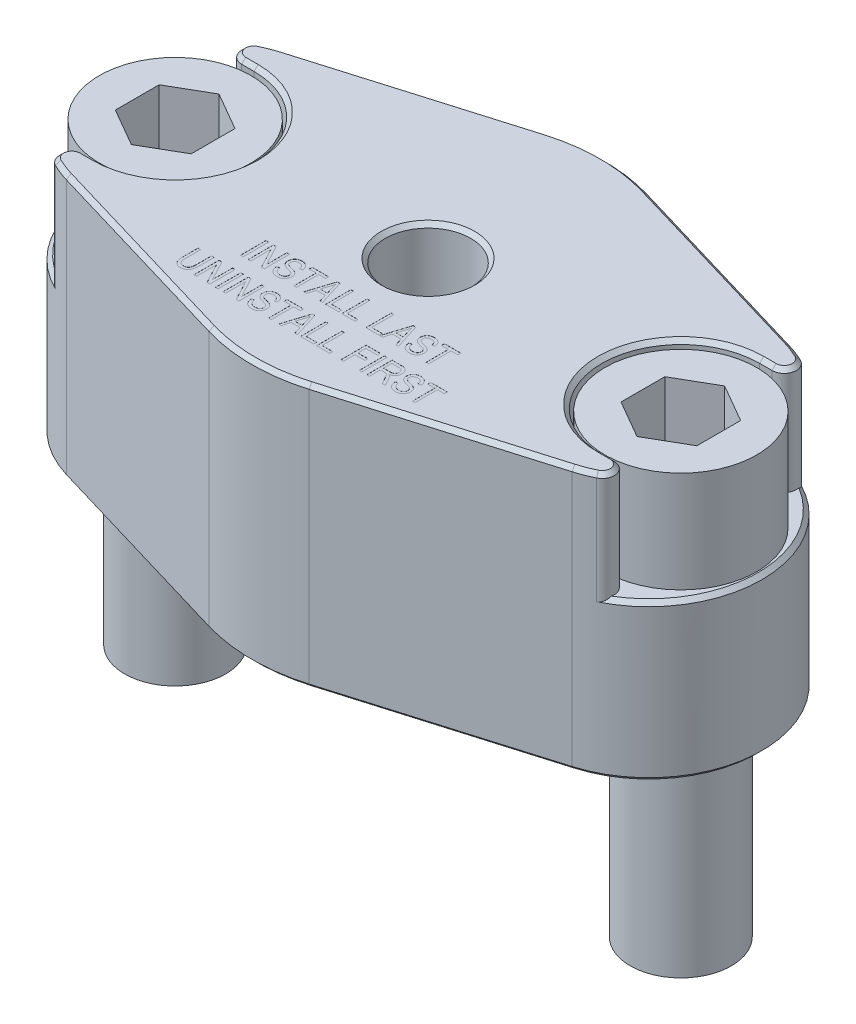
SolidWorks part; units mm, degrees
other "<SHCS50-13L1.75>-<HEX>"
ref_plane "Front Plane" through (0, 0, 0) normal (0, 0, 1) x (1, 0, 0)
ref_plane "Top Plane" through (0, 0, 0) normal (0, 1, 0) x (1, 0, 0)
ref_plane "Right Plane" through (0, 0, 0) normal (1, 0, 0) x (0, 0, -1)
sketch "Sketch1" plane through (0, 0, 0) normal (0, 1, 0) x (1, 0, 0)
  line L0 (-6.2862, 21.2115) -> (-31.7603, 13.6621)
  line L1 (-31.7603, -13.6621) -> (-6.2862, -21.2115)
  line L2 (6.2862, -21.2115) -> (31.7603, -13.6621)
  line L3 (31.7603, 13.6621) -> (6.2862, 21.2115)
  line L4 (-27.7114, 0) -> (27.7114, 0) construction
  line L5 (0, 0) -> (0, 22.9186) construction
  arc A0 (-6.2862, -21.2115) -> (6.2862, -21.2115) centre (0, 0) ccw
  arc A1 (-31.7603, 13.6621) -> (-31.7603, -13.6621) centre (-27.7114, 0) ccw
  arc A2 (31.7603, -13.6621) -> (31.7603, 13.6621) centre (27.7114, 0) ccw
  arc A3 (6.2862, 21.2115) -> (-6.2862, 21.2115) centre (0, 0) ccw
  circle A4 centre (-31.75, 0) radius 6.731
  circle A5 centre (31.75, 0) radius 6.731
  dimension "D1" = 44.2468
  dimension "D2" = 14.2494
  dimension "D3" = 83.9216
  dimension "D5" = 31.75
  dimension "D6" = 13.462
  dimension "D4" = 16.508
extrude "Boss-Extrude1" add sketch "Sketch1" along normal blind 33.0708
sketch "Sketch2" plane through (0, 0, 0) normal (0, -1, 0) x (1, 0, 0)
  circle A0 centre (0, 0) radius 19.177
  dimension "D1" = 38.354
extrude "Cut-Extrude1" cut sketch "Sketch2" against normal blind 15.875
fillet "Fillet1" radius 0.508 1 edges at (0, 15.875, -19.177)
sketch "Sketch3" plane through (0, 33.0708, 0) normal (0, 1, 0) x (1, 0, 0)
  line L0 (-31.75, 9.906) -> (-41.9608, 9.906)
  line L1 (-41.9608, 9.906) -> (-41.9608, -9.906)
  line L2 (-41.9608, -9.906) -> (-31.75, -9.906)
  line L3 (31.75, 9.906) -> (41.9608, 9.906)
  line L4 (41.9608, 9.906) -> (41.9608, -9.906)
  line L5 (41.9608, -9.906) -> (31.75, -9.906)
  arc A0 (-31.75, -9.906) -> (-31.75, 9.906) centre (-31.75, 0) ccw
  arc A1 (31.75, 9.906) -> (31.75, -9.906) centre (31.75, 0) ccw
  arc A2 (-31.7603, 13.6621) -> (-31.7603, -13.6621) centre (-27.7114, 0) ccw construction
  arc A3 (31.7603, -13.6621) -> (31.7603, 13.6621) centre (27.7114, 0) ccw construction
  dimension "D1" = 19.812
extrude "Cut-Extrude2" cut sketch "Sketch3" against normal blind 13.462
hole_wizard "1/2-13 Tapped Hole1" positions "Sketch4" profile "Sketch5" tap size "1/2-13" standard "ANSI Inch"
sketch "Sketch4" plane through (0, 33.0708, 0) normal (0, 1, 0) x (1, 0, 0)
  point P0 (0, 0)
sketch "Sketch5" plane through (0, 33.0708, 0) normal (1, 0, 0) x (0, 0, 1)
  line L0 (0, 0) -> (0, 33.0708)
  line L1 (0, 33.0708) -> (5.3581, 33.0708)
  line L2 (5.3581, 33.0708) -> (5.3581, 0)
  line L5 (5.3581, 0) -> (0, 0)
  line L11 (0, -6.35) -> (0, 107.95) construction
  dimension "Thru Tap Drill Dia." = 10.7163
  dimension "Thru Tap Drill Depth" = 33.0708
fillet "Fillet2" radius 1.524 4 edges at (37.9543, 26.3398, -9.906) (37.9543, 26.3398, 9.906) (-37.9543, 26.3398, 9.906) (-37.9543, 26.3398, -9.906)
chamfer "Chamfer1" distance 0.508 angle 45 34 edges at (19.0232, 33.0708, -17.4368) (32.8857, 33.0708, -13.2767) (32.8857, 33.0708, 13.2767) (19.0232, 33.0708, 17.4368) (0, 33.0708, 22.1234) (-19.0232, 33.0708, 17.4368) (-32.8857, 33.0708, -13.2767) (-32.8857, 33.0708, 13.2767) (-19.0232, 33.0708, -17.4368) (0, 33.0708, -22.1234) (21.844, 33.0708, 0) (-21.844, 33.0708, 0) (0, 33.0708, 5.3581) (31.75, 0, 6.731) (0, 0, -19.177) (-31.75, 0, 6.731) (19.0232, 0, -17.4368) (0, 0, -22.1234) (41.9608, 0, 0) (-19.0232, 0, -17.4368) (19.0232, 0, 17.4368) (-41.9608, 0, 0) (0, 0, 22.1234) (-19.0232, 0, 17.4368) (-32.5276, 33.0708, -9.906) (32.5276, 33.0708, -9.906) (32.5276, 33.0708, 9.906) (-32.5276, 33.0708, 9.906) (34.7899, 33.0708, 11.0862) (-34.7899, 33.0708, 11.0862) (-34.7899, 33.0708, -11.0862) (34.7899, 33.0708, -11.0862) (41.9608, 19.6088, 0) (-41.9608, 19.6088, 0)
sketch "Sketch6" plane through (0, 33.0708, 0) normal (0, 1, 0) x (1, 0, 0)
  line L0 (-19.05, -11.43) -> (19.05, -11.43) construction
  line L1 (0, 21.6154) -> (0, -22.1234) construction
  line L3 (-19.05, -16.51) -> (19.05, -16.51) construction
  arc A0 (6.1419, 20.7245) -> (-6.1419, 20.7245) centre (0, 0) ccw construction
  arc A1 (-6.2862, -21.2115) -> (6.2862, -21.2115) centre (0, 0) ccw construction
  text T0 "INSTALL LAST" font "Arial Narrow" height 3.175
  text T2 "UNINSTALL FIRST" font "Arial Narrow" height 3.175
  point P14 (0, -11.43)
  dimension "D2" = 38.1
  dimension "D4" = 11.43
  dimension "D5" = 5.08
extrude "Cut-Extrude3" cut sketch "Sketch6" against normal blind 0.0127
inserted part "SHCS50-13L1.75"
move or copy body "Body-Move/Copy2" placed by mates yes parameters "D1"=0, "D2"=0, "D3"=0
mirror "Mirror1" about plane through (0, 0, 0) normal (1, 0, 0)
